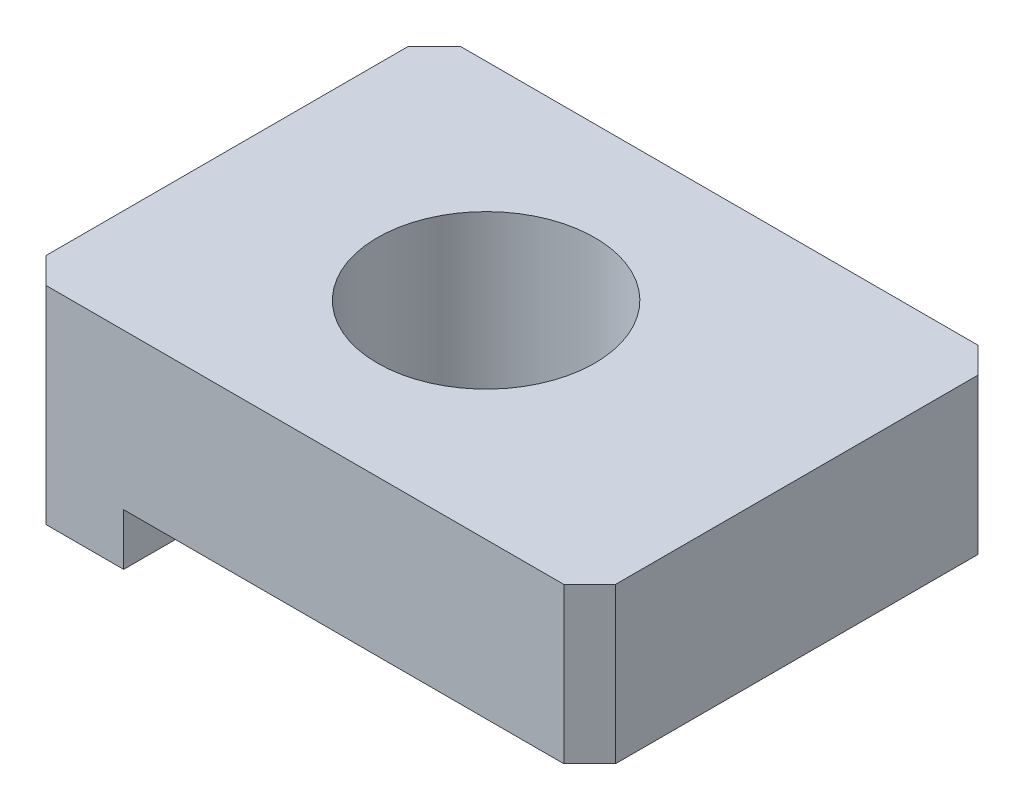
SolidWorks part; units mm, degrees
ref_plane "Plan1" through (0, 0, 0) normal (0, 0, 1) x (1, 0, 0)
ref_plane "Plan2" through (0, 0, 0) normal (0, 1, 0) x (1, 0, 0)
ref_plane "Plan3" through (0, 0, 0) normal (1, 0, 0) x (0, 0, -1)
sketch "Esquisse1" plane through (0, 0, 0) normal (0, 1, 0) x (1, 0, 0)
  line L1 (0, 4) -> (11, 4)
  line L2 (0, 4) -> (0, -4)
  line L3 (0, -4) -> (11, -4)
  line L4 (11, 4) -> (11, -4)
  dimension "D1" = 8
  dimension "D2" = 11
extrude "Boss.-Extru.1" add sketch "Esquisse1" along normal blind 4
hole_wizard "Diamètre du perçage Ø4.2 (4.2)1" positions "Esquisse2" profile "Esquisse3" hole size "Ø4.2" standard "ISO"
sketch "Esquisse2" plane through (0, 4, 0) normal (0, 1, 0) x (1, 0, 0)
  line L0 (-50, 0) -> (50, 0) construction
  line L1 (0, 4) -> (0, -4) construction
  point P0 (5, 0)
  dimension "D1" = 5
sketch "Esquisse3" plane through (5, 4, 0) normal (1, 0, 0) x (0, 0, 1)
  line L0 (0, 0) -> (0, 4)
  line L1 (0, 4) -> (2.1, 4)
  line L2 (2.1, 4) -> (2.1, 0)
  line L5 (2.1, 0) -> (0, 0)
  line L11 (0, -6.35) -> (0, 107.95) construction
  dimension "Diamètre du perçage jusqu'au prochain" = 4.2
  dimension "Profondeur du perçage jusqu'au prochain" = 4
chamfer "Chanfrein1" distance 0.5 angle 45 4 edges at (11, 2, -4) (11, 2, 4) (0, 2, 4) (0, 2, -4)
sketch "Esquisse4" plane through (0, 0, 4) normal (0, 0, 1) x (1, 0, 0)
  line L0 (0.5, 0) -> (10.5, 0) construction
  line L1 (2, 0) -> (12, 0)
  line L2 (2, 0) -> (2, 1)
  line L3 (2, 1) -> (12, 1)
  line L4 (12, 0) -> (12, 1)
  line L5 (0, -50) -> (0, 50) construction
  dimension "D1" = 2
  dimension "D2" = 10
  dimension "D3" = 1
extrude "Enlèv. mat.-Extru.1" cut sketch "Esquisse4" against normal blind 10
